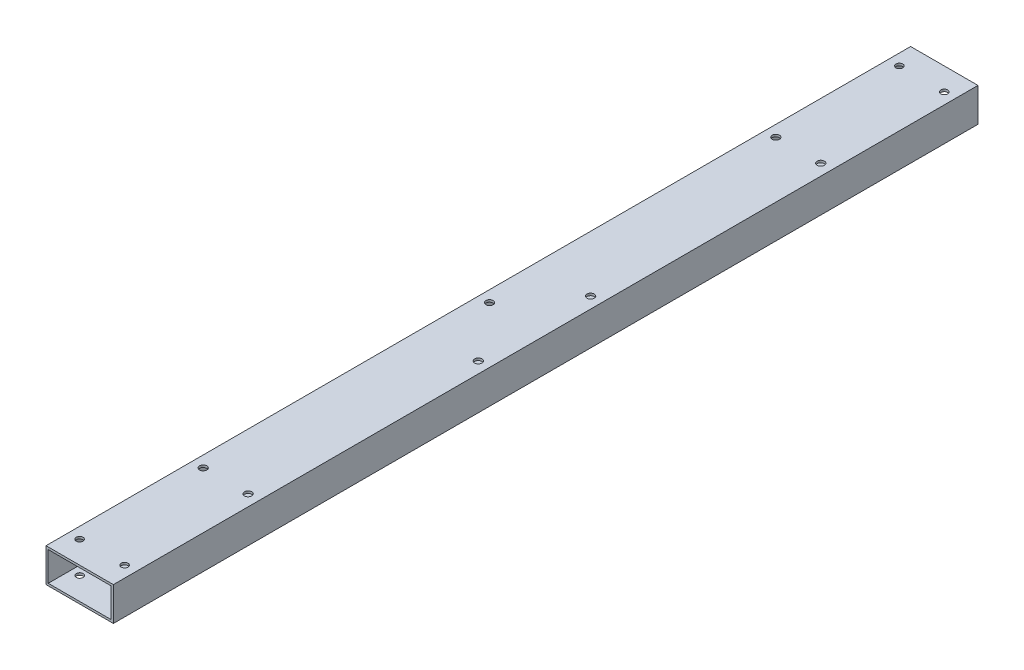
SolidWorks part; units mm, degrees
ref_plane "Front Plane" through (0, 0, 0) normal (0, 0, 1) x (1, 0, 0)
ref_plane "Top Plane" through (0, 0, 0) normal (0, 1, 0) x (1, 0, 0)
ref_plane "Right Plane" through (0, 0, 0) normal (1, 0, 0) x (0, 0, -1)
sketch "Sketch1" plane through (0, 0, 0) normal (0, 0, 1) x (1, 0, 0)
  line L1 (-30, 15) -> (30, 15)
  line L2 (-30, 15) -> (-30, -15)
  line L3 (-30, -15) -> (30, -15)
  line L4 (30, 15) -> (30, -15)
  line L5 (-30, 15) -> (30, -15) construction
  line L6 (-30, -15) -> (30, 15) construction
  line L7 (-28, 13) -> (28, 13)
  line L8 (-28, 13) -> (-28, -13)
  line L9 (-28, -13) -> (28, -13)
  line L10 (28, 13) -> (28, -13)
  line L11 (-28, 13) -> (28, -13) construction
  line L12 (-28, -13) -> (28, 13) construction
  point P4 (0, 0)
  point P12 (0, 0)
  dimension "D1" = 60
  dimension "D2" = 30
  dimension "D3" = 26
  dimension "D4" = 56
extrude "Boss-Extrude1" add sketch "Sketch1" along normal mid plane 770
sketch "Sketch2" plane through (0, 15, 0) normal (0, 1, 0) x (1, 0, 0)
  line L0 (-20, 365) -> (20, 365) construction
  line L1 (0, 385) -> (0, 365) construction
  line L2 (30, 385) -> (-30, 385) construction
  line L4 (-20, 285) -> (20, 285) construction
  line L5 (-20, 285) -> (-20, 255) construction
  line L6 (-20, 255) -> (20, 255) construction
  line L7 (20, 285) -> (20, 255) construction
  line L8 (-20, 285) -> (20, 255) construction
  line L9 (-20, 255) -> (20, 285) construction
  circle A0 centre (-20, 365) radius 3.05
  circle A1 centre (20, 365) radius 3.05
  circle A4 centre (-20, 255) radius 3.25
  circle A5 centre (20, 255) radius 3.25
  circle A6 centre (-20, 0) radius 3.25
  circle A7 centre (20, 50) radius 3.25
  point P12 (0, 270)
  dimension "D1" = 40
  dimension "D2" = 6.1
  dimension "D6" = 50
  dimension "D7" = 6.5
  dimension "D3" = 20
  dimension "D4" = 270
  dimension "D5" = 40
  dimension "D8" = 30
extrude "Cut-Extrude1" cut sketch "Sketch2" against normal through all both and the other way through all
sketch "Sketch3" plane through (0, -15, 0) normal (0, 1, 0) x (1, 0, 0)
  circle A0 centre (-20, 255) radius 3.25 construction
  circle A2 centre (20, 255) radius 3.25 construction
  circle A4 centre (-20, 255) radius 3.25 construction
  circle A6 centre (20, 255) radius 3.25 construction
  circle A10 centre (20, 255) radius 8
  circle A12 centre (-20, 255) radius 8
  circle A13 centre (-20, 0) radius 3.25 construction
  circle A14 centre (20, 50) radius 3.25 construction
  circle A15 centre (-20, 0) radius 3.25 construction
  circle A16 centre (20, 50) radius 3.25 construction
  circle A17 centre (20, 50) radius 8
  circle A18 centre (-20, 0) radius 8
  dimension "D2" = 16
extrude "Cut-Extrude2" cut sketch "Sketch3" against normal up to surface (28 mm away)
mirror "Mirror1" about plane through (0, 0, 0) normal (0, 0, 1) of "Cut-Extrude2", "Cut-Extrude1"
